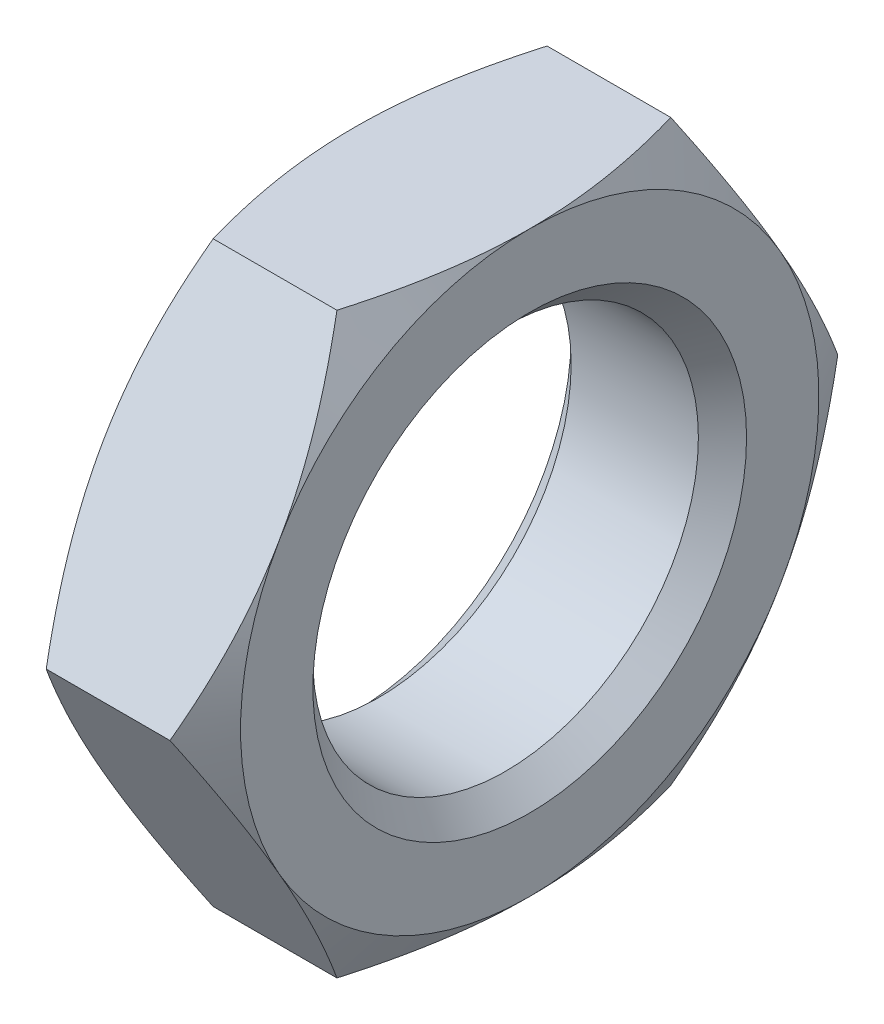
SolidWorks part; units mm, degrees
ref_plane "Front Plane" through (0, 0, 0) normal (0, 0, 1) x (1, 0, 0)
ref_plane "Top Plane" through (0, 0, 0) normal (0, 1, 0) x (1, 0, 0)
ref_plane "Right Plane" through (0, 0, 0) normal (1, 0, 0) x (0, 0, -1)
sketch "Sketch1" plane through (0, 0, 0) normal (1, 0, 0) x (0, 0, -1)
  line L1 (8.6603, 15) -> (-8.6603, 15)
  line L2 (-8.6603, 15) -> (-17.3205, 0)
  line L3 (-17.3205, 0) -> (-8.6603, -15)
  line L4 (-8.6603, -15) -> (8.6603, -15)
  line L5 (8.6603, -15) -> (17.3205, 0)
  line L6 (17.3205, 0) -> (8.6603, 15)
  circle A0 centre (0, 0) radius 15 construction
  circle A1 centre (0, 0) radius 10
extrude "Extrude1" add sketch "Sketch1" along normal blind 9.1
sketch "Sketch2" plane through (0, 0, 0) normal (0, 0, 1) x (1, 0, 0)
  line L0 (9.1, 15) -> (9.1, 60)
  line L1 (9.1, 60) -> (0, 60)
  line L2 (0, 60) -> (0, 15)
  line L3 (0, 15) -> (4.55, 22.8808)
  line L4 (4.55, 22.8808) -> (9.1, 15)
revolve "Cut-Revolve1" cut sketch "Sketch2" angle 360 about axis through (9.1, 0, 0) along (-1, 0, 0)
chamfer "Chamfer1" distance 1.25 angle 45 2 edges at (0, 0, -10) (9.1, 0, -10)
equation "\"D2@Sketch2\"=\"D1@Sketch1\"*2"
